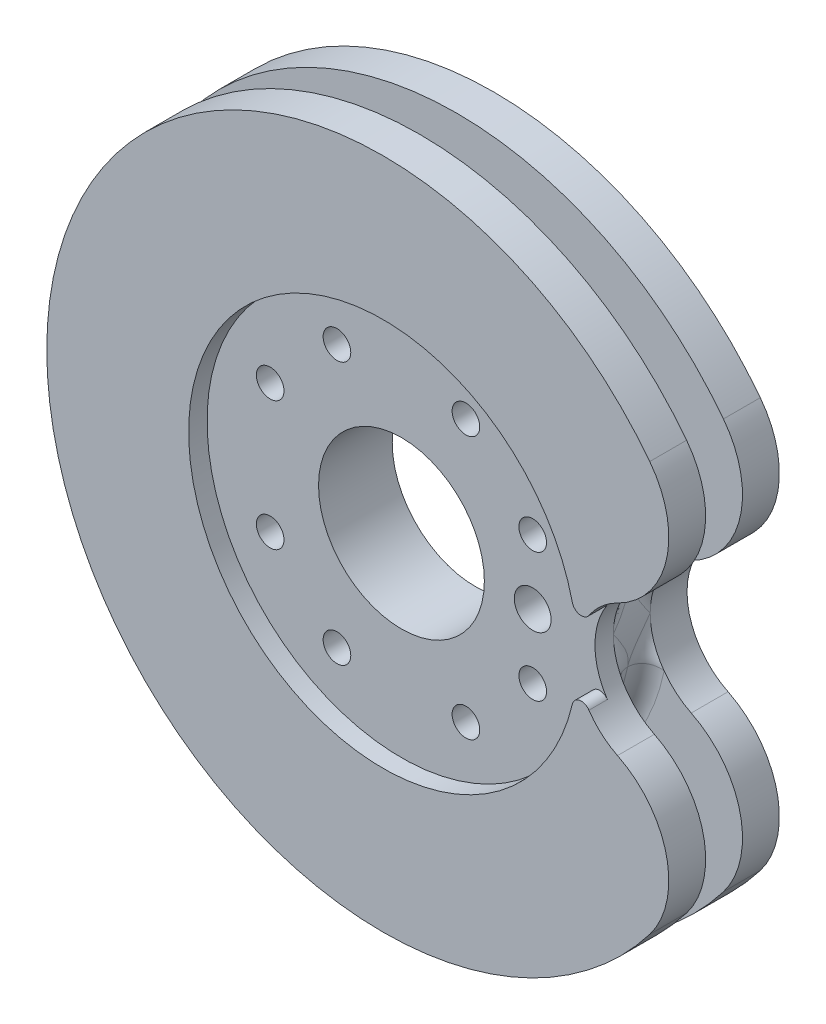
SolidWorks part; units mm, degrees
ref_plane "Front Plane" through (0, 0, 0) normal (0, 0, 1) x (1, 0, 0)
ref_plane "Top Plane" through (0, 0, 0) normal (0, 1, 0) x (1, 0, 0)
ref_plane "Right Plane" through (0, 0, 0) normal (1, 0, 0) x (0, 0, -1)
sketch "values-params_print" plane through (0, 0, 0) normal (0, 0, 1) x (1, 0, 0)
  line L0 (0, 0) -> (0.7, 0) construction
  line L1 (0, -5.2349) -> (3, -5.2349) construction
  line L2 (0, -10.104) -> (4, -10.104) construction
  line L3 (0, -15.1093) -> (105, -15.1093) construction
  line L4 (0, -19.837) -> (0.15, -19.837) construction
  line L5 (0, -24.2596) -> (0.4, -24.2596) construction
  line L6 (0, -28.606) -> (3.175, -28.606) construction
  line L7 (0, -33.0286) -> (9.5, -33.0286) construction
  line L8 (0, -37.6038) -> (2.4, -37.6038) construction
  line L9 (0, -43.1661) -> (6.35, -43.1661) construction
  dimension "width destroy" = 0.7
  dimension "width keep" = 3
  dimension "width tab" = 4
  dimension "base diameter" = 105
  dimension "print fit" = 0.15
  dimension "print free" = 0.4
  dimension "pin diameter" = 3.175
  dimension "pulley diameter" = 9.5
  dimension "pulley thickness" = 2.4
  dimension "base pin diameter" = 6.35
inserted part "params_print"
sketch "Sketch1" plane through (0, 0, 0) normal (0, 0, 1) x (1, 0, 0)
  line L0 (0, 18.25) -> (0, -18.25) construction
  line L1 (0, 0) -> (-18.25, 0) construction
  circle A0 centre (0, 0) radius 18.25
  circle A1 centre (0, 0) radius 3.6
  point P24 (0, 0)
  dimension "D1" = 36.5
  dimension "D2" = 7.2
extrude "Main Body" add sketch "Sketch1" along normal mid plane 6
sketch "Sketch2" plane through (0, 0, 3) normal (0, 0, 1) x (1, 0, 0)
  circle A0 centre (0, 0) radius 3.6 construction
  circle A1 centre (0, 0) radius 3.6
  circle A2 centre (0, 0) radius 1.425
  dimension "D1" = 2.85
extrude "Main Bolt Surface" add sketch "Sketch2" against normal offset from surface (3.15 mm away) 2.85
sketch "Sketch4" plane through (0, 0, 0) normal (0, 0, 1) x (1, 0, 0)
  circle A0 centre (0, 0) radius 18.25 construction
  circle A1 centre (0, 0) radius 18.25
  circle A2 centre (0, 0) radius 10.5
  dimension "D1" = 21
extrude "Pulley Slot" cut sketch "Sketch4" against normal mid plane 2
sketch "Sketch6" plane through (0, 0, 3) normal (0, 0, 1) x (1, 0, 0)
  line L0 (0, 18.25) -> (0, -18.25) construction
  line L1 (0, 0) -> (14.5, 0) construction
  circle A0 centre (0, 0) radius 18.25 construction
  circle A1 centre (14.5, 0) radius 4
  circle A3 centre (0, 0) radius 10.5 construction
  dimension "D1" = 8
extrude "Tendon Anchor Clearance" cut sketch "Sketch6" against normal through all
fillet "Inner Contouring" radius 1 2 edges at (10.5, 0, -1) (10.5, 0, 1)
sketch "Sketch8" plane through (0, 0, -3) normal (0, 0, -1) x (-1, 0, 0)
  line L0 (-3.6, 0) -> (-10.5, 0) construction
  line L1 (0, 0) -> (0, 15) construction
  circle A2 centre (0, 0) radius 3.6 construction
  arc A3 (-18.1832, -1.5602) -> (-18.1832, 1.5602) centre (-14.5, 0) ccw construction
  circle A4 centre (-7.125, 0) radius 1
  dimension "D1" = 2
  dimension "D2" = 7.125
extrude "Tendon Anchor" cut sketch "Sketch8" against normal through all
fillet "Contouring" radius 5 4 edges at (18.1832, -1.5602, 2) (18.1832, 1.5602, 2) (18.1832, -1.5602, -2) (18.1832, 1.5602, -2)
ref_point "Ref Center"
sketch "Sketch9" plane through (0, 0, -3) normal (0, 0, -1) x (-1, 0, 0)
  line L0 (-10.5, 0) -> (18.25, 0) construction
  line L1 (7.125, 0) -> (7.125, -3.5) construction
  arc A0 (-12.727, -3.5856) -> (-12.727, 3.5856) centre (-14.5, 0) ccw construction
  arc A1 (-14.4771, -11.112) -> (-14.4771, 11.112) centre (0, 0) ccw construction
  circle A3 centre (7.125, -3.5) radius 0.75
  circle A4 centre (7.125, 3.5) radius 0.75
  circle A6 centre (-3.5, -7.125) radius 0.75
  circle A7 centre (3.5, -7.125) radius 0.75
  circle A9 centre (-7.125, 3.5) radius 0.75
  circle A10 centre (-7.125, -3.5) radius 0.75
  circle A12 centre (3.5, 7.125) radius 0.75
  circle A13 centre (-3.5, 7.125) radius 0.75
  point P12 (0, 0)
  point P37 (0, 0)
  dimension "D2" = 1.5
  dimension "D3" = 7
  dimension "D1" = 7.125
  dimension "D4" = 4
extrude "Cut-Extrude1" cut sketch "Sketch9" against normal through all
sketch "Sketch10" plane through (0, 0, 3) normal (0, 0, 1) x (1, 0, 0)
  circle A0 centre (0, 0) radius 10.55
  dimension "D1" = 21.1
extrude "Cut-Extrude4" cut sketch "Sketch10" against normal blind 1
sketch "Sketch11" plane through (0, 0, -3) normal (0, 0, -1) x (-1, 0, 0)
  circle A0 centre (0, 0) radius 6.75
  dimension "D1" = 13.5
extrude "Cut-Extrude5" cut sketch "Sketch11" against normal blind 1
sketch "Sketch12" plane through (0, 0, -2) normal (0, 0, -1) x (-1, 0, 0)
  circle A0 centre (0, 0) radius 4.5
  dimension "D1" = 9
extrude "Cut-Extrude6" cut sketch "Sketch12" against normal through all
fillet "Fillet1" radius 0.5 4 edges at (6.6897, 0.9003, -2.5) (6.6897, -0.9003, -2.5) (10.5363, 0.5376, 2.5) (10.5363, -0.5376, 2.5)
equation "\"D2@Sketch1\"=6.85 + \"print free@values@params_print.SLDPRT\""
equation "\"D1@Sketch2\" = 2.5 + \"print free@values@params_print.SLDPRT\""
equation "\"D1@Sketch8\"=\"width keep@values@params_print.SLDPRT\" / 3*2"
